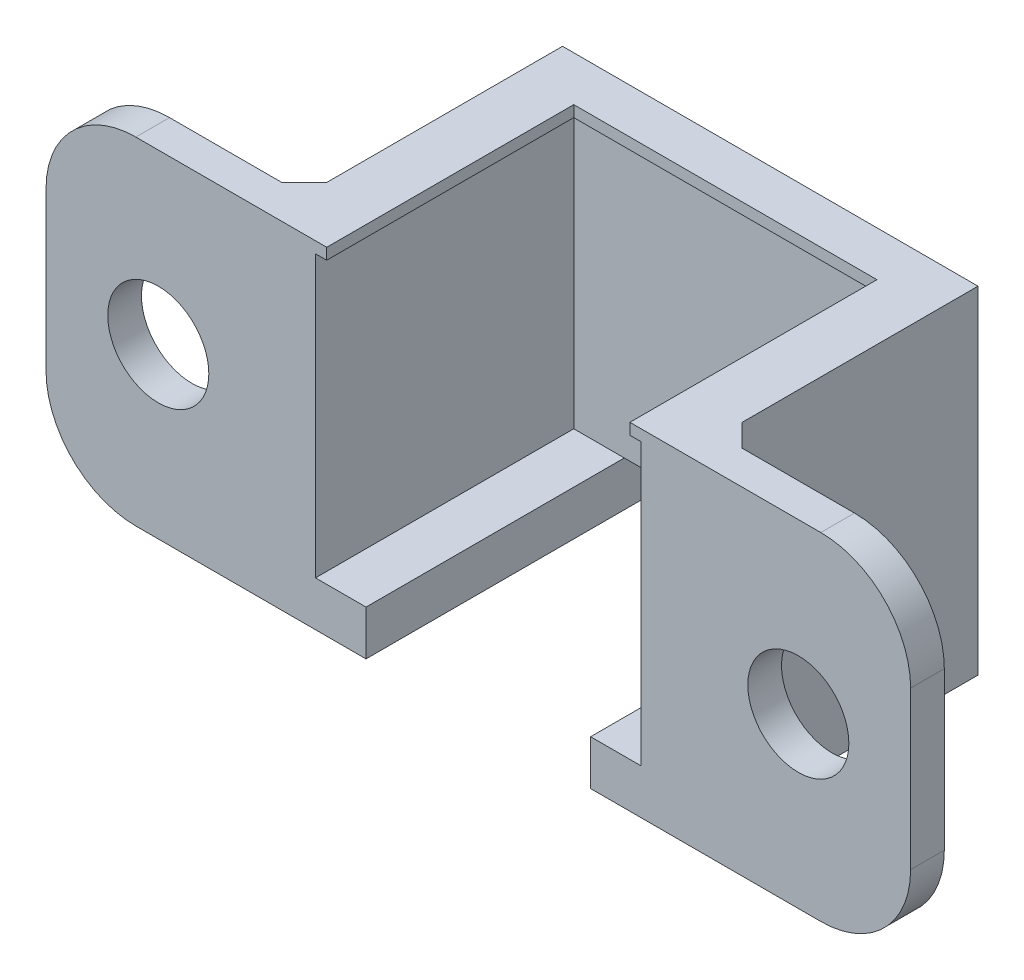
SolidWorks part; units mm, degrees
ref_plane "Front Plane" through (0, 0, 0) normal (0, 0, 1) x (1, 0, 0)
ref_plane "Top Plane" through (0, 0, 0) normal (0, 1, 0) x (1, 0, 0)
ref_plane "Right Plane" through (0, 0, 0) normal (1, 0, 0) x (0, 0, -1)
sketch "Sketch1" plane through (0, 0, 0) normal (0, 0, 1) x (1, 0, 0)
  line L0 (0, 0) -> (0, 15)
  line L1 (2, 2) -> (16.5, 2)
  line L2 (2, 2) -> (2, 13)
  line L4 (16.5, 2) -> (16.5, 13)
  line L5 (2, 2) -> (16.5, 13) construction
  line L6 (2, 13) -> (16.5, 2) construction
  line L7 (0, 15) -> (2, 15)
  line L8 (18.5, 0) -> (18.5, 15)
  line L9 (0, 0) -> (18.5, 0)
  line L10 (2, 13) -> (2, 15)
  line L11 (16.5, 13) -> (16.5, 15)
  line L12 (16.5, 15) -> (18.5, 15)
  point P0 (8.125, 6.5)
  dimension "D1" = 14.5
  dimension "D2" = 11
  dimension "D3" = 2
  dimension "D4" = 15
  dimension "D5" = 2
  dimension "D6" = 2
  dimension "D7" = 2
extrude "Boss-Extrude1" add sketch "Sketch1" along normal blind 13 contours L11 L4 L1 L2 L10 L7 L0 L9 L8
sketch "Sketch2" plane through (0, 0, 0) normal (0, 0, 1) x (1, 0, 0)
  line L0 (18.5, 0) -> (18.5, 15) construction
  line L1 (0, 0) -> (18.5, 0) construction
  line L2 (0, 0) -> (0, 15) construction
  line L3 (18.5, 0) -> (18.5, 15)
  line L4 (0, 0) -> (18.5, 0)
  line L5 (0, 0) -> (0, 15)
  line L6 (0, 15) -> (18.5, 15)
extrude "Boss-Extrude2" add sketch "Sketch2" along normal blind 1.5
sketch "Sketch3" plane through (0, 0, 0) normal (0, -1, 0) x (1, 0, 0)
  line L0 (9.25, 0) -> (4.25, 0)
  line L1 (0, 0) -> (18.5, 0) construction
  line L2 (4.25, 0) -> (4.25, 13)
  line L3 (4.25, 13) -> (14.25, 13)
  line L4 (14.25, 13) -> (14.25, 0)
  line L5 (14.25, 0) -> (9.25, 0)
  dimension "D1" = 13
  dimension "D2" = 10
  dimension "D3" = 5
extrude "Cut-Extrude1" cut sketch "Sketch3" against normal blind 2
sketch "Sketch5" plane through (0, 15, 0) normal (0, 1, 0) x (1, 0, 0)
  line L8 (16.5, -13) -> (16.5, -1.5) construction
  line L9 (2, -13) -> (2, -1.5) construction
  line L10 (16.5, -13) -> (16.5, -1.5)
  line L11 (2, -13) -> (2, -1.5)
  line L12 (2.5, -13) -> (2.5, -2)
  line L13 (16.5, -13) -> (16, -13)
  line L14 (2.5, -13) -> (2, -13)
  line L15 (16, -13) -> (16, -2)
  line L29 (2, -1.5) -> (16.5, -1.5)
  line L30 (16, -2) -> (2.5, -2)
  line L32 (2.5, -13) -> (2.5, -1.5) construction
  line L33 (16, -13) -> (16, -1.5) construction
  dimension "D3" = 0.5
  dimension "D1" = 0.5
  dimension "D2" = 0.5
extrude "Boss-Extrude3" add sketch "Sketch5" against normal blind 0.5
sketch "Sketch6" plane through (0, 0, 13) normal (0, 0, 1) x (1, 0, 0)
  line L1 (18.5, 0) -> (28.5, 0)
  line L2 (18.5, 0) -> (18.5, 15)
  line L3 (18.5, 15) -> (28.5, 15)
  line L4 (28.5, 0) -> (28.5, 15)
  dimension "D1" = 10
extrude "Boss-Extrude4" add sketch "Sketch6" against normal blind 1.5
hole_wizard "M4 Clearance Hole1" positions "Sketch7" profile "Sketch8" hole size "M4" standard "ANSI Metric"
sketch "Sketch7" plane through (0, 0, 11.5) normal (0, 0, -1) x (-1, 0, 0)
  line L0 (-28.5, 15) -> (-18.5, 15) construction
  line L1 (-28.5, 0) -> (-28.5, 15) construction
  point P0 (-23.5, 7.5)
  point P5 (-23.5, 15)
  point P8 (-28.5, 7.5)
sketch "Sketch8" plane through (23.5, 7.5, 11.5) normal (1, 0, 0) x (0, 1, 0)
  line L0 (0, 0) -> (0, 14.0519)
  line L1 (0, 14.0519) -> (2.25, 12.7)
  line L2 (2.25, 12.7) -> (2.25, 0)
  line L5 (2.25, 0) -> (0, 0)
  line L10 (0, 14.0519) -> (-2.25, 12.7) construction
  line L11 (0, -6.35) -> (0, 107.95) construction
  dimension "Hole Dia." = 4.5
  dimension "Hole Depth" = 12.7
  dimension "Drill Angle" = 118
fillet "Fillet1" radius 4 2 edges at (28.5, 0, 12.25) (28.5, 15, 12.25)
ref_plane "Plane1" through (9.25, 0, 0) normal (1, 0, 0) x (0, 0, -1)
mirror "Mirror3" about plane through (9.25, 0, 0) normal (1, 0, 0) of "Fillet1", "M4 Clearance Hole1", "Boss-Extrude4"
chamfer "Chamfer1" distance 1 angle 45 2 edges at (18.5, 7.5, 11.5) (0, 7.5, 11.5)
